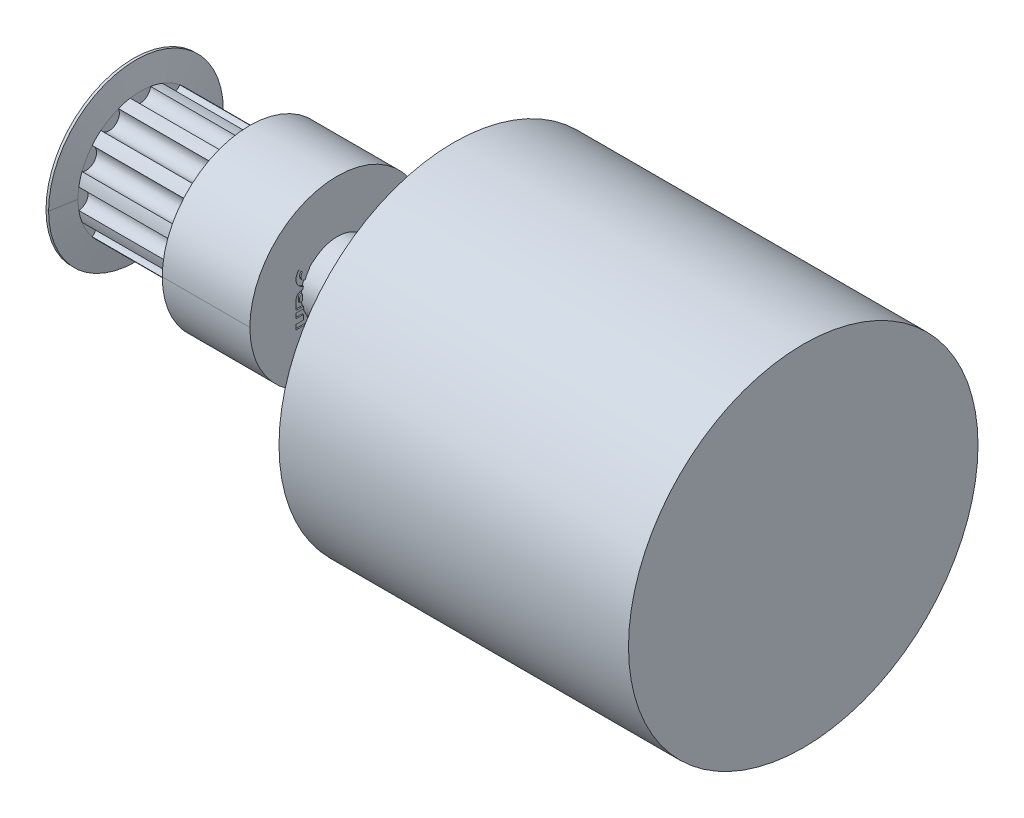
SolidWorks part; units mm, degrees
ref_plane "Plan de face" through (0, 0, 0) normal (0, 0, 1) x (1, 0, 0)
ref_plane "Plan de dessus" through (0, 0, 0) normal (0, 1, 0) x (1, 0, 0)
ref_plane "Plan de droite" through (0, 0, 0) normal (1, 0, 0) x (0, 0, -1)
imported_body "Importée11"
ref_plane "Plan1" through (0, 0, -75.8652) normal (0, 0, 1) x (1, 0, 0)
sketch "Esquisse1" plane through (0, 0, -75.8652) normal (0, 0, 1) x (1, 0, 0)
  line L0 (9.6084, 153.1934) -> (85.4246, 153.1934) construction
  line L3 (32.0572, 153.1934) -> (32.0572, 156.1934)
  line L4 (32.0572, 156.1934) -> (44.0572, 156.1934)
  line L5 (44.0572, 156.1934) -> (44.0572, 168.1934)
  line L6 (44.0572, 168.1934) -> (74.0572, 168.1934)
  line L7 (74.0572, 168.1934) -> (74.0572, 153.1934)
  line L8 (74.0572, 153.1934) -> (32.0572, 153.1934)
  line L9 (34.0572, 153.1934) -> (34.0572, 160.6934) construction
  line L10 (26.5363, 153.1934) -> (34.0572, 153.1934) construction
  dimension "D1" = 2
  dimension "D2" = 10
  dimension "D3" = 30
  dimension "D4" = 30
  dimension "D5" = 6
revolve "Révolution1" add sketch "Esquisse1" angle 360 about L0
